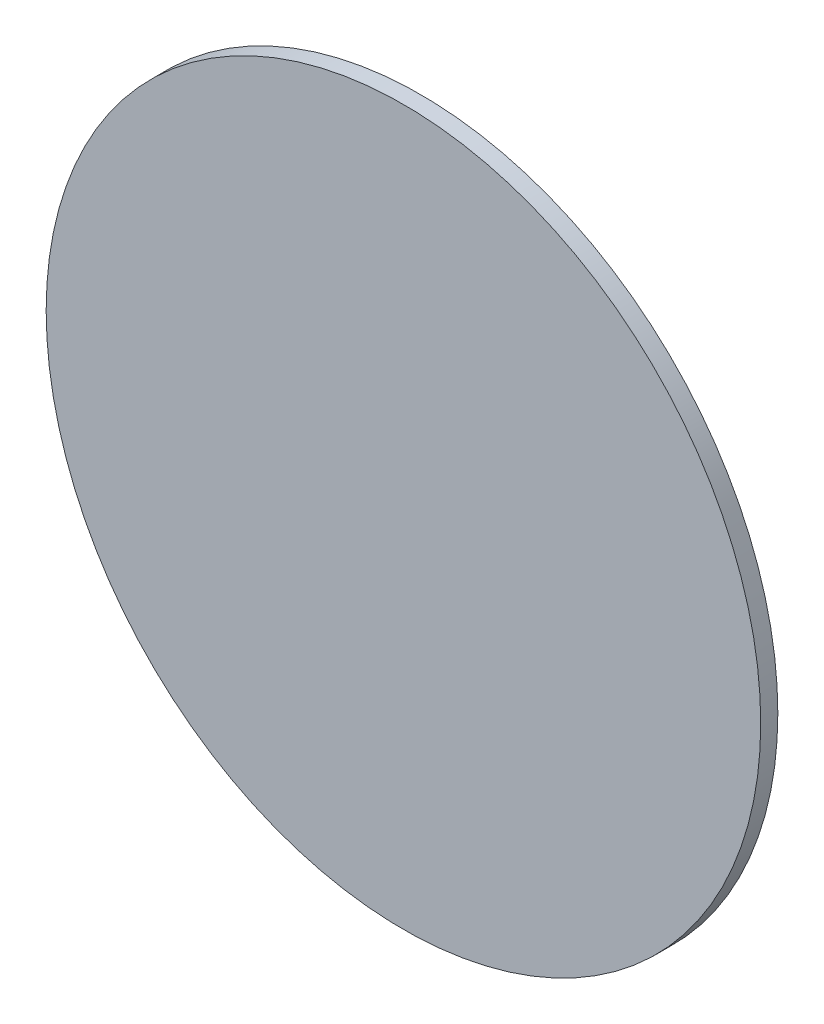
SolidWorks part; units mm, degrees
ref_plane "Front Plane" through (0, 0, 0) normal (0, 0, 1) x (1, 0, 0)
ref_plane "Top Plane" through (0, 0, 0) normal (0, 1, 0) x (1, 0, 0)
ref_plane "Right Plane" through (0, 0, 0) normal (1, 0, 0) x (0, 0, -1)
sketch "Sketch1" plane through (0, 0, 0) normal (0, 0, 1) x (1, 0, 0)
  circle A0 centre (0, 0) radius 10.45
  dimension "D1" = 20.9
extrude "Boss-Extrude1" add sketch "Sketch1" along normal blind 0.5
